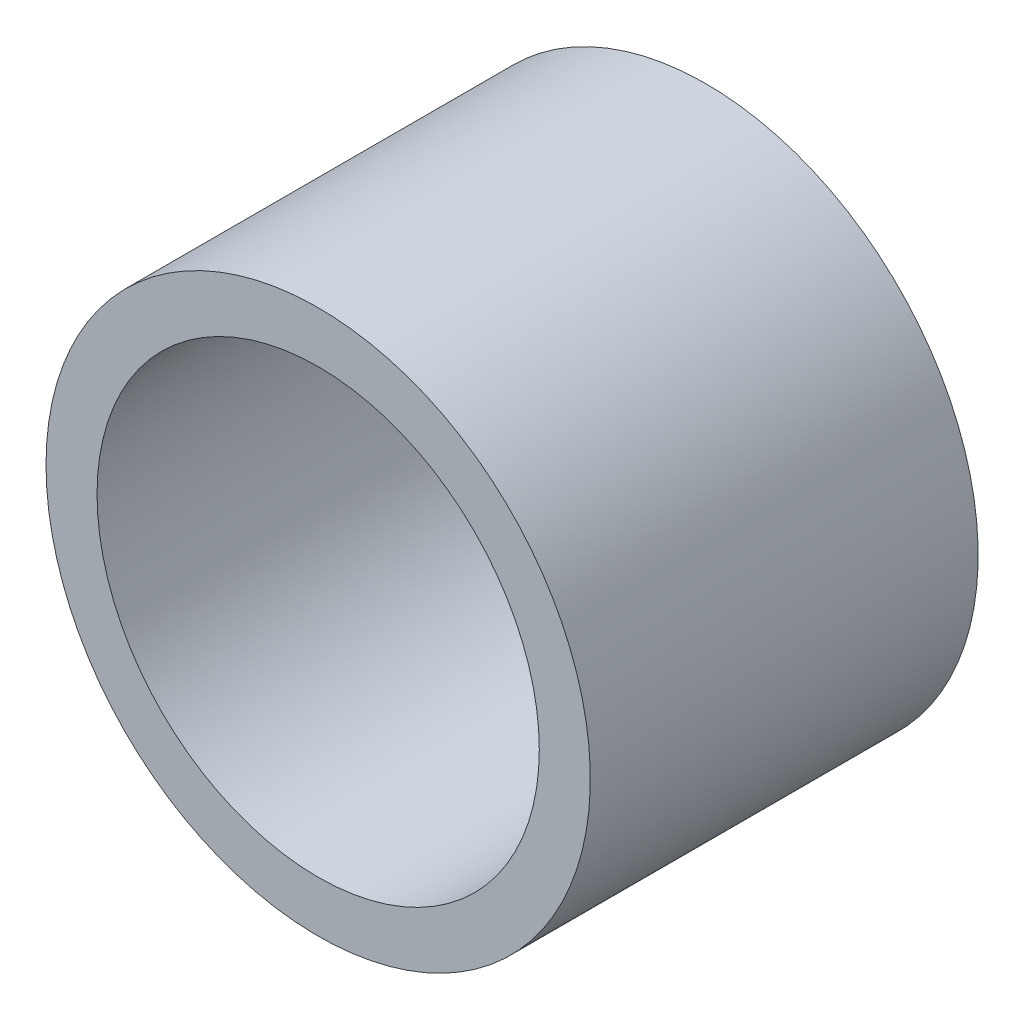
SolidWorks part; units mm, degrees
ref_plane "Plan de face" through (0, 0, 0) normal (0, 0, 1) x (1, 0, 0)
ref_plane "Plan de dessus" through (0, 0, 0) normal (0, 1, 0) x (1, 0, 0)
ref_plane "Plan de droite" through (0, 0, 0) normal (1, 0, 0) x (0, 0, -1)
sketch "Esquisse1" plane through (0, 0, 0) normal (0, 0, 1) x (1, 0, 0)
  circle A0 centre (0, 0) radius 20
  circle A1 centre (0, 0) radius 16.25
  dimension "D1" = 32.5
  dimension "D2" = 40
extrude "Boss.-Extru.1" add sketch "Esquisse1" along normal blind 28.5
